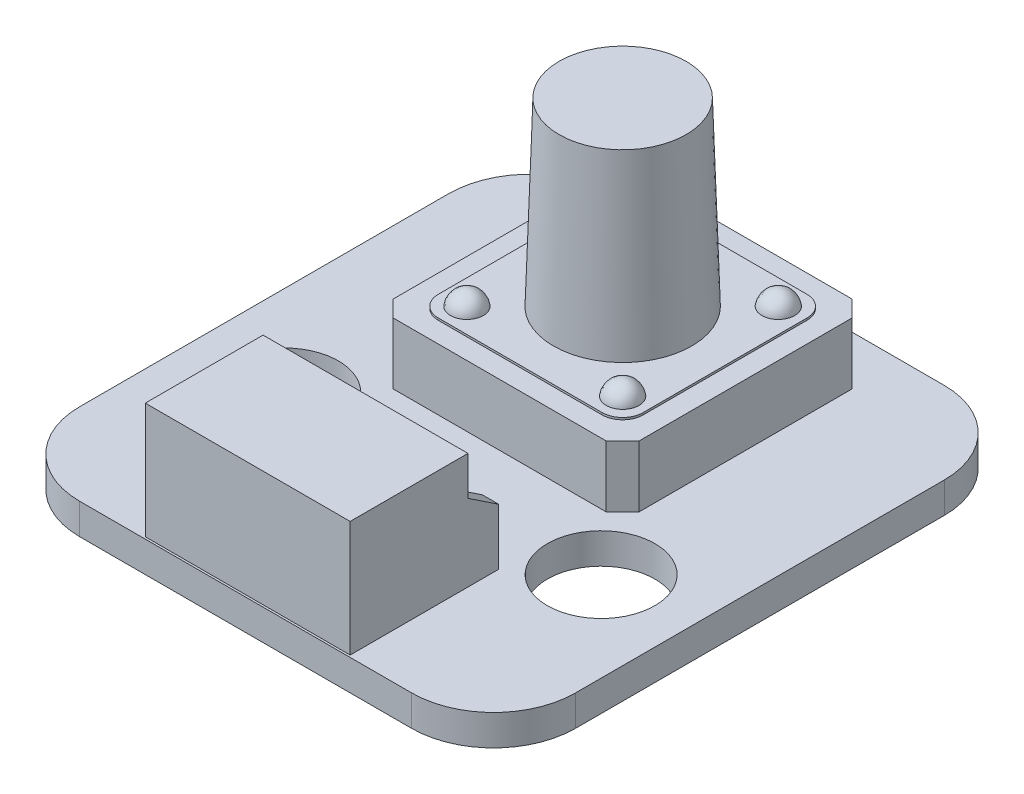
SolidWorks part; units mm, degrees
ref_plane "Front Plane" through (0, 0, 0) normal (0, 0, 1) x (1, 0, 0)
ref_plane "Top Plane" through (0, 0, 0) normal (0, 1, 0) x (1, 0, 0)
ref_plane "Right Plane" through (0, 0, 0) normal (1, 0, 0) x (0, 0, -1)
sketch "Sketch1" plane through (0, 0, 0) normal (0, 1, 0) x (1, 0, 0)
  line L0 (4, 26) -> (20.2, 26)
  line L1 (4, 0) -> (20.2, 0)
  line L2 (0, 4) -> (0, 22)
  line L4 (24.2, 4) -> (24.2, 22)
  line L7 (12.1, 19.8) -> (12.1, 0) construction
  circle A0 centre (4.375, 9.625) radius 2.625
  circle A1 centre (19.825, 9.625) radius 2.625
  arc A2 (20.2, 0) -> (24.2, 4) centre (20.2, 4) ccw
  arc A3 (24.2, 22) -> (20.2, 26) centre (20.2, 22) ccw
  arc A4 (0, 22) -> (4, 26) centre (4, 22) cw
  arc A5 (4, 0) -> (0, 4) centre (4, 4) cw
  point P1 (4.375, 9.625)
  point P13 (19.825, 9.625)
  point P17 (0, 26)
  point P21 (0, 0)
  dimension "D3" = 4
  dimension "D1" = 24.2
  dimension "D2" = 26
extrude "Boss-Extrude1" add sketch "Sketch1" along normal blind 1.5
sketch "Sketch8" plane through (0, 1.5, 0) normal (0, 1, 0) x (1, 0, 0)
  line L0 (0, 4) -> (0, 22) construction
  line L1 (7.1, 7.35) -> (17.1, 7.35)
  line L2 (7.1, 7.35) -> (7.1, 0)
  line L3 (7.1, 0) -> (17.1, 0)
  line L4 (17.1, 7.35) -> (17.1, 0)
  line L5 (4, 0) -> (20.2, 0) construction
  dimension "D1" = 10
  dimension "D2" = 7.1
  dimension "D3" = 7.35
extrude "Boss-Extrude6" add sketch "Sketch8" along normal blind 5.65
sketch "Sketch13" plane through (0, 0, 0) normal (0, 0, 1) x (1, 0, 0)
  line L1 (7.1, 7.15) -> (17.1, 7.15)
  line L2 (7.1, 7.15) -> (7.1, 1.5)
  line L3 (7.1, 1.5) -> (17.1, 1.5)
  line L4 (17.1, 7.15) -> (17.1, 1.5)
extrude "Cut-Extrude3" cut sketch "Sketch13" against normal blind 0.1
sketch "Sketch9" plane through (7.1, 0, 0) normal (-1, 0, 0) x (0, 0, 1)
  line L0 (-7.35, 1.5) -> (-7.35, 4.25)
  line L1 (-5.85, 7.15) -> (-5.85, 5.25)
  line L2 (-5.85, 5.25) -> (-7.35, 4.25)
  line L3 (-7.35, 7.15) -> (-7.35, 1.5) construction
  line L4 (-7.35, 7.15) -> (-0.1, 7.15) construction
  line L5 (-7.35, 1.5) -> (-0.1, 1.5) construction
  line L6 (-7.35, 4.25) -> (-7.35, 7.15)
  line L7 (-7.35, 7.15) -> (-5.85, 7.15)
  dimension "D1" = 2.75
  dimension "D2" = 1.9
  dimension "D3" = 2.9
  dimension "D4" = 1.5
  dimension "D5" = 1.5
extrude "Cut-Extrude1" cut sketch "Sketch9" against normal blind 10 contours L2 L1 M5 M6
ref_plane "Plane2" through (0, 5.25, 0) normal (0, 1, 0) x (1, 0, 0)
sketch "Sketch10" plane through (0, 5.25, 0) normal (0, 1, 0) x (1, 0, 0)
  line L0 (17.1, 5.85) -> (7.1, 5.85) construction
  line L1 (7.9, 7.35) -> (16.3, 7.35)
  line L2 (7.9, 7.35) -> (7.9, 5.85)
  line L3 (7.9, 5.85) -> (16.3, 5.85)
  line L4 (16.3, 7.35) -> (16.3, 5.85)
  line L5 (17.1, 7.35) -> (7.1, 7.35) construction
  line L6 (17.1, 5.85) -> (17.1, 7.35) construction
  line L7 (7.1, 7.35) -> (7.1, 0.1) construction
  dimension "D1" = 0.8
  dimension "D2" = 0.8
extrude "Cut-Extrude2" cut sketch "Sketch10" against normal up to surface (3.75 mm away)
sketch "Sketch11" plane through (0, 0, -5.85) normal (0, 0, -1) x (-1, 0, 0)
  line L0 (-16.3, 1.5) -> (-16.3, 4.25) construction
  line L1 (-14.4, 4.2843) -> (-13.9, 4.2843)
  line L2 (-14.4, 4.2843) -> (-14.4, 1.5)
  line L3 (-14.4, 1.5) -> (-13.9, 1.5)
  line L4 (-9.8, 4.2843) -> (-9.8, 1.5)
  line L5 (-7.9, 1.5) -> (-7.9, 4.25) construction
  line L6 (-13.9, 4.2843) -> (-13.9, 1.5)
  line L7 (-12.35, 4.2843) -> (-12.35, 1.5)
  line L8 (-11.85, 4.2843) -> (-11.85, 1.5)
  line L9 (-10.3, 4.2843) -> (-10.3, 1.5)
  line L10 (-12.35, 4.2843) -> (-11.85, 4.2843)
  line L11 (-10.3, 4.2843) -> (-9.8, 4.2843)
  line L12 (-12.35, 1.5) -> (-11.85, 1.5)
  line L13 (-10.3, 1.5) -> (-9.8, 1.5)
  dimension "D1" = 1.9
  dimension "D2" = 1.9
  dimension "D7" = 0.5
  dimension "D8" = 0.5
  dimension "D9" = 0.5
  dimension "D10" = 1.55
extrude "Boss-Extrude7" add sketch "Sketch11" along normal blind 0.5
fillet "Fillet1" radius 0.5 3 edges at (10.05, 4.2843, -6.35) (12.1, 4.2843, -6.35) (14.15, 4.2843, -6.35)
sketch "Sketch12" plane through (0, 0, -6.35) normal (0, 0, -1) x (-1, 0, 0)
  line L1 (-14.4, 1.5) -> (-13.9, 1.5)
  line L2 (-14.4, 1.5) -> (-14.4, 2)
  line L3 (-14.4, 2) -> (-13.9, 2)
  line L4 (-13.9, 1.5) -> (-13.9, 2)
  line L5 (-12.35, 1.5) -> (-11.85, 1.5)
  line L6 (-12.35, 1.5) -> (-12.35, 2)
  line L7 (-12.35, 2) -> (-11.85, 2)
  line L8 (-11.85, 1.5) -> (-11.85, 2)
  line L9 (-10.3, 1.5) -> (-9.8, 1.5)
  line L10 (-10.3, 1.5) -> (-10.3, 2)
  line L11 (-10.3, 2) -> (-9.8, 2)
  line L12 (-9.8, 1.5) -> (-9.8, 2)
  dimension "D1" = 0.5
  dimension "D2" = 0.5
  dimension "D3" = 0.5
extrude "Boss-Extrude8" add sketch "Sketch12" along normal blind 2
fillet "Fillet2" radius 0.5 3 edges at (10.05, 2, -8.35) (12.1, 2, -8.35) (14.15, 2, -8.35)
sketch "Sketch14" plane through (0, 1.5, 0) normal (0, 1, 0) x (1, 0, 0)
  line L0 (4, 26) -> (20.2, 26) construction
  line L1 (6.9, 24.4) -> (17.3, 24.4)
  line L2 (6.1, 23.6) -> (6.1, 13.2)
  line L3 (6.9, 12.4) -> (17.3, 12.4)
  line L4 (18.1, 23.6) -> (18.1, 13.2)
  line L5 (0, 4) -> (0, 22) construction
  line L6 (6.1, 23.6) -> (6.9, 24.4)
  line L7 (17.3, 24.4) -> (18.1, 23.6)
  line L8 (17.3, 12.4) -> (18.1, 13.2)
  line L9 (6.1, 13.2) -> (6.9, 12.4)
  point P0 (6.1, 24.4)
  point P1 (18.1, 12.4)
  point P2 (6.1, 12.4)
  point P3 (18.1, 24.4)
  dimension "D1" = 12
  dimension "D2" = 12
  dimension "D3" = 1.6
  dimension "D4" = 6.1
extrude "Boss-Extrude9" add sketch "Sketch14" along normal blind 3
sketch "Sketch15" plane through (0, 4.5, 0) normal (0, 1, 0) x (1, 0, 0)
  line L0 (6.9, 12.4) -> (17.3, 12.4) construction
  line L1 (8.1, 23.4) -> (16.1, 23.4)
  line L2 (7.1, 22.4) -> (7.1, 14.4)
  line L3 (8.1, 13.4) -> (16.1, 13.4)
  line L4 (17.1, 22.4) -> (17.1, 14.4)
  line L5 (18.1, 13.2) -> (18.1, 23.6) construction
  arc A0 (7.1, 14.4) -> (8.1, 13.4) centre (8.1, 14.4) ccw
  arc A1 (16.1, 13.4) -> (17.1, 14.4) centre (16.1, 14.4) ccw
  arc A2 (16.1, 23.4) -> (17.1, 22.4) centre (16.1, 22.4) cw
  arc A3 (8.1, 23.4) -> (7.1, 22.4) centre (8.1, 22.4) ccw
  dimension "D5" = 1
  dimension "D1" = 10
  dimension "D2" = 10
  dimension "D3" = 1
  dimension "D4" = 1
extrude "Boss-Extrude10" add sketch "Sketch15" along normal blind 0.1
sketch "Sketch17" plane through (0, 4.6, 0) normal (0, 1, 0) x (1, 0, 0)
  line L0 (16.1, 23.4) -> (8.1, 23.4) construction
  line L1 (7.1, 22.4) -> (7.1, 14.4) construction
  point P0 (8.3, 22.2)
  dimension "D1" = 1.2
  dimension "D2" = 1.2
ref_plane "Plane3" through (0, 0, -22.2) normal (0, 0, 1) x (1, 0, 0)
sketch "Sketch18" plane through (0, 0, -22.2) normal (0, 0, 1) x (1, 0, 0)
  line L0 (8.3, 4.6) -> (7.5, 4.6)
  line L1 (8.3, 4.6) -> (8.3, 5.3)
  arc A0 (7.5, 4.6) -> (8.3, 5.3) centre (8.2937, 4.5) cw
  dimension "D1" = 0.8
  dimension "D2" = 0.7
revolve "Revolve1" add sketch "Sketch18" angle 360 about L1
pattern_linear "LPattern1" count 2 spacing 7.6 along (1, 0, 0) count 2 spacing 7.6 along (0, 0, 1) of "Revolve1"
sketch "Sketch19" plane through (0, 4.6, 0) normal (0, 1, 0) x (1, 0, 0)
  line L0 (12.1, 23.4) -> (12.1, 13.4) construction
  line L1 (7.1, 18.4) -> (17.1, 18.4) construction
  dimension "D1" = 10
  dimension "D2" = 10
ref_plane "Plane4" through (0, 0, -18.4) normal (0, 0, 1) x (1, 0, 0)
sketch "Sketch20" plane through (0, 0, -18.4) normal (0, 0, 1) x (1, 0, 0)
  line L0 (12.1, 4.6) -> (8.725, 4.6)
  line L1 (8.725, 4.6) -> (9, 13.4)
  line L2 (9, 13.4) -> (12.1, 13.4)
  line L3 (12.1, 13.4) -> (12.1, 4.6)
  line L4 (7.1, 4.6) -> (17.1, 4.6) construction
  dimension "D1" = 3.375
  dimension "D3" = 3.1
  dimension "D4" = 8.8
revolve "Revolve2" add sketch "Sketch20" angle 360 about L3
